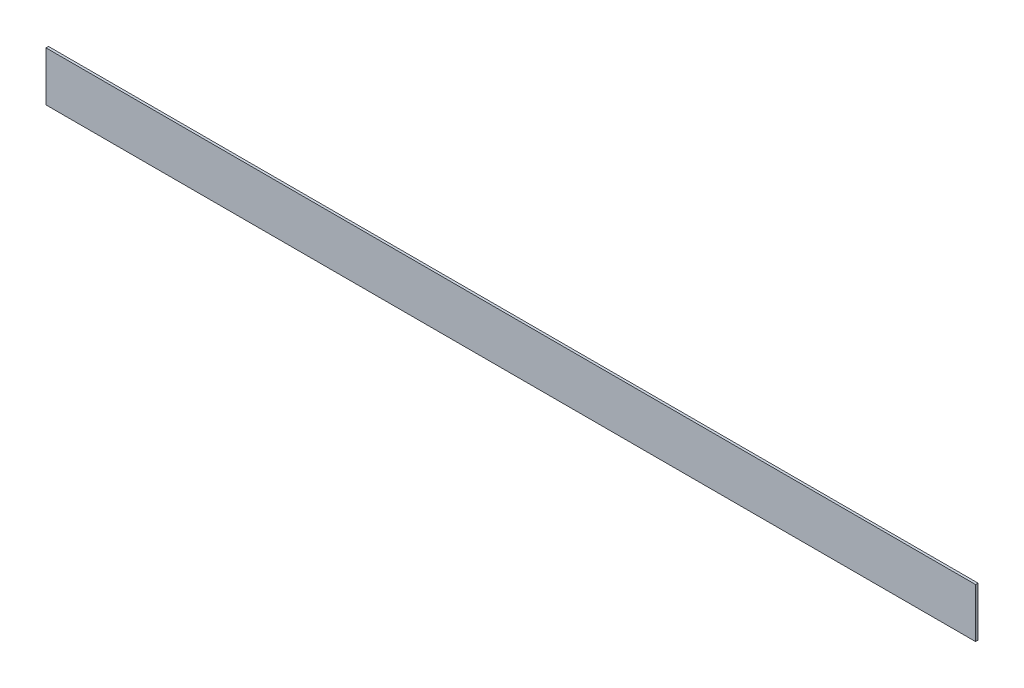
SolidWorks part; units mm, degrees
ref_plane "Front Plane" through (0, 0, 0) normal (0, 0, 1) x (1, 0, 0)
ref_plane "Top Plane" through (0, 0, 0) normal (0, 1, 0) x (1, 0, 0)
ref_plane "Right Plane" through (0, 0, 0) normal (1, 0, 0) x (0, 0, -1)
sketch "Sketch3" plane through (0, 0, 0) normal (0, 0, 1) x (1, 0, 0)
  line L1 (0, 0) -> (2387.6, 0)
  line L2 (0, 0) -> (0, 127)
  line L3 (0, 127) -> (2387.6, 127)
  line L4 (2387.6, 0) -> (2387.6, 127)
  line L5 (0, 0) -> (2387.6, 127) construction
  line L6 (0, 127) -> (2387.6, 0) construction
  point P4 (1193.8, 63.5)
extrude "Boss-Extrude1" add sketch "Sketch3" along normal blind 6.35
equation "\"system_width\"= 7ft + 10 "
equation "\"system_length\"= 95.5"
equation "\"module_board_length\"= 11.25in"
equation "\"module_board_width\"= 1.5in"
equation "\"module_width\"= (\"system_width\" -  2* \"module_trim_thickness\") / 2"
equation "\"module_board_short_depth\"= \"module_width\" - ( 2 * \"module_board_width\" ) - \"module_lip_width\""
equation "\"module_board_hole\"= 0.5in"
equation "\"module_board_hole_seperation\"= 20in"
equation "\"system_step_width\"= 3ft"
equation "\"system_top_length\"= \"system_length\" - \"system_step_length\""
equation "\"module_top_thickness\"= 0.75in"
equation "\"module_lip_width\"= 1.5in"
equation "\"module_trim_thickness\"= 1in"
equation "\"module_trim_height\"= 14in"
equation "\"module_top_overhang\"= 4.5in"
equation "\"module_trim_angle\"= 45deg"
equation "\"module_length\"= (\"system_top_length\" - \"module_trim_thickness\")/ 2"
equation "\"module_board_long_depth\"= \"module_length\" - \"module_lip_width\""
equation "\"module_board_hole_position\"= ( ( \"module_width\" - \"module_board_hole_seperation\" ) / 2 ) + \"module_board_width\"/2"
equation "\"upper_overhang_depth\"= 3in"
equation "\"upper_overhang_thickness\"= 0.25in"
equation "\"D1@Sketch3\"=\"system_width\""
equation "\"D2@Sketch3\"=\"upper_overhang_depth\" +2in"
equation "\"D1@Boss-Extrude1\"=\"upper_overhang_thickness\""
equation "\"step_board_length\"= 5.5in"
equation "\"step_board_width\"= 1.5in"
equation "\"system_step_length\"= 2ft+11.5"
equation "\"step_module_width\"= \"module_width\""
equation "\"step_module_length\"= \"system_step_length\" - \"module_trim_thickness\""
equation "\"step_board_short_depth\"= \"step_module_length\" - \"module_lip_width\""
equation "\"step_board_long_depth\"= \"step_module_width\" - (2 * \"module_board_width\") - \"module_lip_width\""
equation "\"step_trim_height\"= 8in"
